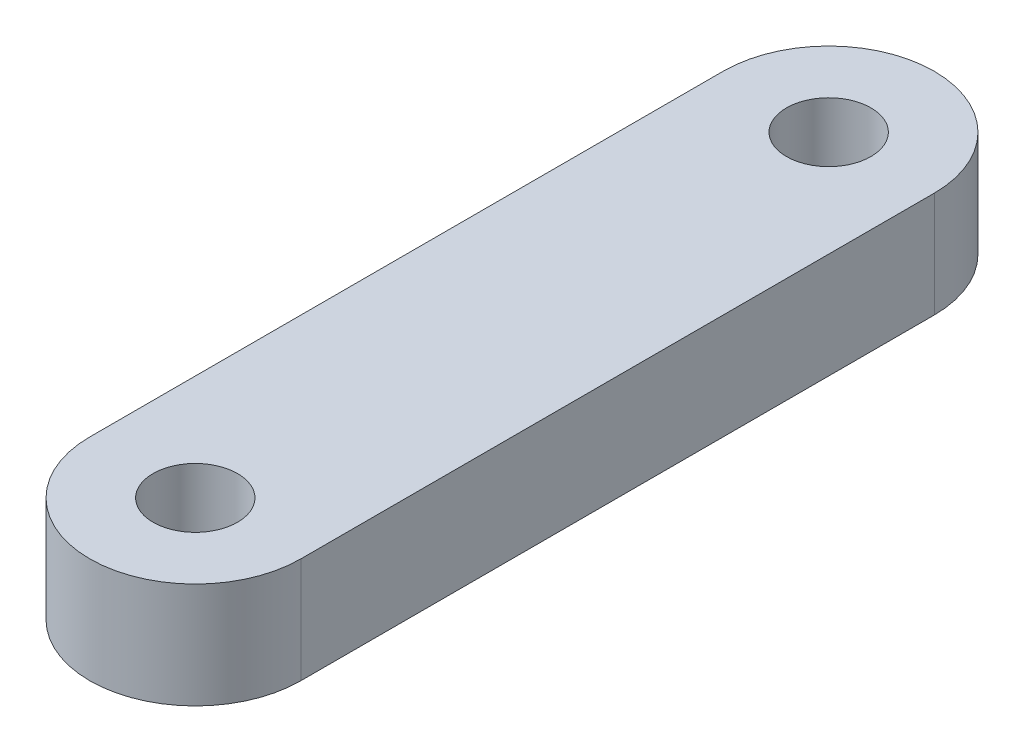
SolidWorks part; units mm, degrees
ref_plane "Front Plane" through (0, 0, 0) normal (0, 0, 1) x (1, 0, 0)
ref_plane "Top Plane" through (0, 0, 0) normal (0, 1, 0) x (1, 0, 0)
ref_plane "Right Plane" through (0, 0, 0) normal (1, 0, 0) x (0, 0, -1)
sketch "Sketch1" plane through (0, 0, 0) normal (0, 1, 0) x (1, 0, 0)
  line L0 (0, -15) -> (0, 15) construction
  line L1 (5, -15) -> (5, 15)
  line L2 (-5, -15) -> (-5, 15)
  circle A0 centre (0, 15) radius 2
  circle A1 centre (0, -15) radius 2
  arc A2 (5, -15) -> (-5, -15) centre (0, -15) cw
  arc A3 (5, 15) -> (-5, 15) centre (0, 15) ccw
  point P4 (0, 0)
  dimension "D2" = 4
  dimension "D1" = 30
  dimension "D3" = 5
  dimension "D4" = 5
extrude "Boss-Extrude1" add sketch "Sketch1" along normal blind 5
